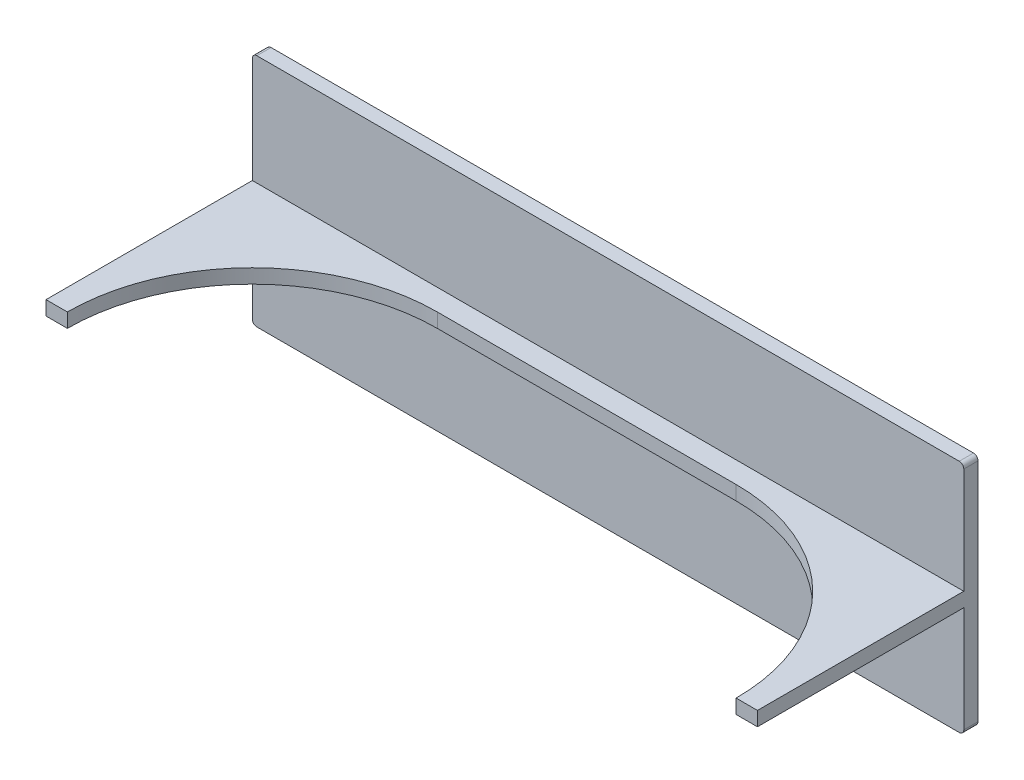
SolidWorks part; units mm, degrees
ref_plane "Plan de face" through (0, 0, 0) normal (0, 0, 1) x (1, 0, 0)
ref_plane "Plan de dessus" through (0, 0, 0) normal (0, 1, 0) x (1, 0, 0)
ref_plane "Plan de droite" through (0, 0, 0) normal (1, 0, 0) x (0, 0, -1)
sketch "Esquisse1" plane through (0, 0, 0) normal (0, 0, 1) x (1, 0, 0)
  line L1 (-250, -82.55) -> (250, -82.55)
  line L2 (-250, -82.55) -> (-250, 82.55)
  line L3 (-250, 82.55) -> (250, 82.55)
  line L4 (250, -82.55) -> (250, 82.55)
  line L5 (-250, -82.55) -> (250, 82.55) construction
  line L6 (-250, 82.55) -> (250, -82.55) construction
  point P0 (0, 0)
  dimension "D1" = 165.1
  dimension "D2" = 500
extrude "Boss.-Extru.1" add sketch "Esquisse1" along normal blind 10
fillet "Congé1" radius 3.18 4 edges at (250, -82.55, 5) (250, 82.55, 5) (-250, 82.55, 5) (-250, -82.55, 5)
sketch "Esquisse2" plane through (0, 0, 0) normal (0, 1, 0) x (1, 0, 0)
  line L0 (-250, -10) -> (-250, -155)
  line L1 (-250, -155) -> (-235, -155)
  line L2 (-105, -25) -> (0, -25)
  line L3 (0, -25) -> (0, 0)
  line L4 (246.82, -10) -> (-246.82, -10) construction
  line L5 (-250, -10) -> (-246.82, -10) construction
  line L6 (-250, -10) -> (-246.82, -10)
  line L7 (246.82, -10) -> (-246.82, -10)
  arc A0 (-235, -155) -> (-105, -25) centre (-105, -155) cw
  dimension "D1" = 130
  dimension "D2" = 15
  dimension "D3" = 15
extrude "Boss.-Extru.2" add sketch "Esquisse2" along normal mid plane 10 contours L1 A0 L2 L3 L7 L6 L0
mirror "Symétrie1" about plane through (0, 0, 0) normal (1, 0, 0) of "Boss.-Extru.2"
